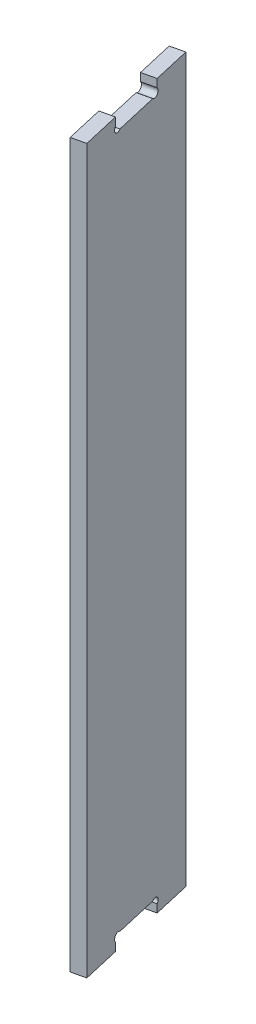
SolidWorks part; units mm, degrees
ref_plane "Alzado" through (0, 0, 0) normal (0, 0, 1) x (1, 0, 0)
ref_plane "Planta" through (0, 0, 0) normal (0, 1, 0) x (1, 0, 0)
ref_plane "Vista lateral" through (0, 0, 0) normal (1, 0, 0) x (0, 0, -1)
sketch "Croquis2" plane through (0, 0, 0) normal (0, 1, 0) x (1, 0, 0)
  line L0 (390, 0) -> (411.3617, -92.5672)
  line L1 (390, 0) -> (380.2561, -2.2486)
  line L2 (411.3617, -92.5672) -> (401.6177, -94.8158)
  line L3 (380.2561, -2.2486) -> (401.6177, -94.8158)
  line L4 (390, 10) -> (415.4316, -100.2037) construction
  dimension "D1" = 10
  dimension "D2" = 95
extrude "Saliente-Extruir1" add sketch "Croquis2" along normal up to surface (500 mm away)
sketch "Croquis3" plane through (360.537, 0, -83.2008) normal (-0.9744, 0, 0.2249) x (0.2249, 0, 0.9744)
  line L1 (182.6952, 0) -> (155.1952, 0)
  line L2 (182.6952, 0) -> (182.6952, -10)
  line L3 (182.6952, -10) -> (155.1952, -10)
  line L4 (155.1952, 0) -> (155.1952, -10)
  line L5 (87.6952, 0) -> (115.1952, 0)
  line L6 (87.6952, 0) -> (87.6952, -10)
  line L7 (87.6952, -10) -> (115.1952, -10)
  line L8 (115.1952, 0) -> (115.1952, -10)
  dimension "D1" = 10
  dimension "D2" = 10
  dimension "D3" = 40
extrude "Saliente-Extruir3" add sketch "Croquis3" against normal blind 10
sketch "Croquis4" plane through (360.537, 0, -83.2008) normal (-0.9744, 0, 0.2249) x (0.2249, 0, 0.9744)
  line L0 (115.1952, -2.1213) -> (117.3165, -2.1213) construction
  line L1 (115.1952, -10) -> (115.1952, 0) construction
  line L2 (117.3165, -2.1213) -> (117.3165, 0) construction
  line L3 (115.1952, 0) -> (155.1952, 0) construction
  line L4 (135.1952, 0) -> (135.1952, -17.3015) construction
  line L5 (153.0739, -2.1213) -> (153.0739, 0) construction
  line L6 (155.1952, -2.1213) -> (153.0739, -2.1213) construction
  circle A0 centre (117.3165, -2.1213) radius 3
  circle A1 centre (153.0739, -2.1213) radius 3
  dimension "D1" = 6
extrude "Cortar-Extruir1" cut sketch "Croquis4" against normal through all both and the other way through all
ref_plane "Plano2" through (0, 250, 0) normal (0, -1, 0) x (-1, 0, 0)
mirror "Simetría3" about plane through (0, 250, 0) normal (0, -1, 0) of "Saliente-Extruir3", "Cortar-Extruir1"
